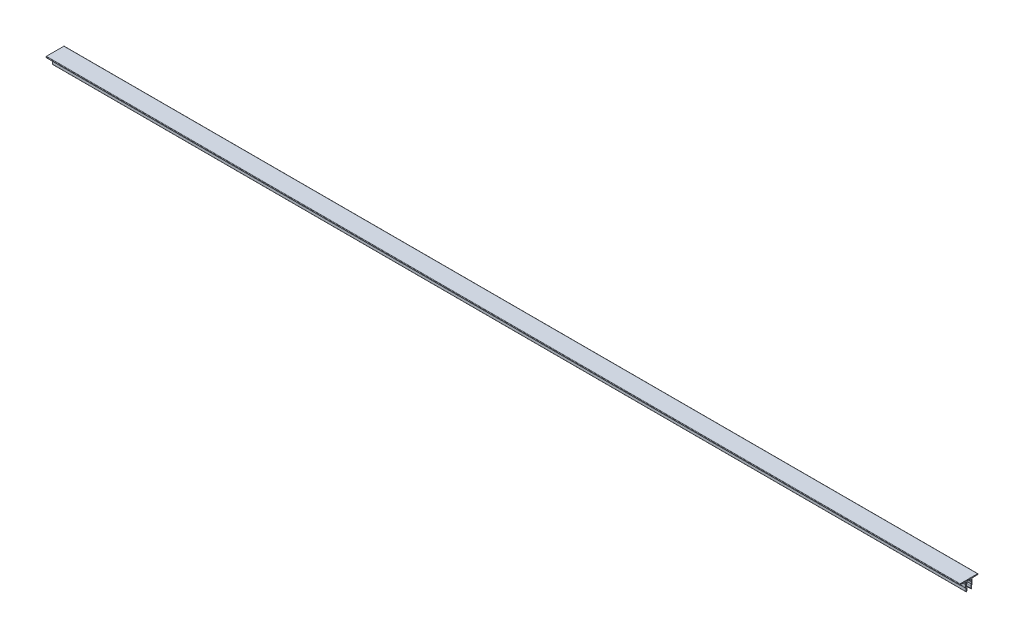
SolidWorks part; units mm, degrees
ref_plane "正面" through (0, 0, 0) normal (0, 0, 1) x (1, 0, 0)
ref_plane "平面" through (0, 0, 0) normal (0, 1, 0) x (1, 0, 0)
ref_plane "右側面" through (0, 0, 0) normal (1, 0, 0) x (0, 0, -1)
sketch "ｽｹｯﾁ2" plane through (0, 0, 0) normal (1, 0, 0) x (0, 0, -1)
  line L0 (10, -1) -> (10, -0.5)
  line L1 (-10, -1) -> (-10, -0.5)
  line L6 (-4, -1) -> (-10, -1)
  line L7 (1.7, -1) -> (-1.7, -1)
  line L67 (10, -1) -> (4, -1)
  line L68 (9.5, 0) -> (-9.5, 0)
  line L73 (2.6, -11) -> (2.8, -11)
  line L74 (-3.1, -10.7) -> (-3.1, -7.6865)
  line L75 (-2.1, -10.134) -> (-2.1, -7.6865)
  line L76 (2.1, -10.134) -> (2.1, -7.6865)
  line L77 (-2.1, -10.134) -> (-2.6, -11)
  line L78 (-2.6, -11) -> (-2.8, -11)
  line L79 (2.1, -10.134) -> (2.6, -11)
  line L80 (-3.7, -6.6472) -> (-3.7, -3.7247)
  line L81 (-2.7, -6.1765) -> (-2.7, -4.2902)
  line L82 (-2.2, -3.4242) -> (-2.2, -1.5)
  line L83 (-3.2, -2.7) -> (-3.2, -1.8)
  line L84 (2.7, -6.1765) -> (2.7, -4.2902)
  line L85 (2.2, -3.4242) -> (2.2, -1.5)
  line L86 (3.1, -10.7) -> (3.1, -7.6865)
  line L87 (3.2, -2.7) -> (3.2, -1.8)
  line L88 (3.7, -6.6472) -> (3.7, -3.7247)
  arc A0 (4, -1) -> (3.2, -1.8) centre (4, -1.8) ccw
  arc A1 (-4, -1) -> (-3.2, -1.8) centre (-4, -1.8) cw
  arc A2 (2.2, -1.5) -> (1.7, -1) centre (1.7, -1.5) ccw
  arc A3 (-1.7, -1) -> (-2.2, -1.5) centre (-1.7, -1.5) ccw
  arc A4 (10, -0.5) -> (9.5, 0) centre (9.5, -0.5) ccw
  arc A5 (-9.5, 0) -> (-10, -0.5) centre (-9.5, -0.5) ccw
  arc A71 (2.7, -4.2902) -> (2.45, -3.8572) centre (2.2, -4.2902) ccw
  arc A72 (-3.1, -10.7) -> (-2.8, -11) centre (-2.8, -10.7) ccw
  arc A73 (-3.7, -6.6472) -> (-3.45, -7.0803) centre (-3.2, -6.6472) ccw
  arc A74 (-3.1, -7.6865) -> (-3.45, -7.0803) centre (-3.8, -7.6865) ccw
  arc A75 (-3.5077, -3.3306) -> (-3.7, -3.7247) centre (-3.2, -3.7247) ccw
  arc A76 (-3.5077, -3.3306) -> (-3.2, -2.7) centre (-4, -2.7) ccw
  arc A77 (-2.45, -3.8572) -> (-2.2, -3.4242) centre (-2.7, -3.4242) ccw
  arc A78 (-2.45, -3.8572) -> (-2.7, -4.2902) centre (-2.2, -4.2902) ccw
  arc A79 (2.2, -3.4242) -> (2.45, -3.8572) centre (2.7, -3.4242) ccw
  arc A80 (2.8, -11) -> (3.1, -10.7) centre (2.8, -10.7) ccw
  arc A81 (3.45, -7.0803) -> (3.7, -6.6472) centre (3.2, -6.6472) ccw
  arc A82 (3.7, -3.7247) -> (3.5077, -3.3306) centre (3.2, -3.7247) ccw
  arc A83 (3.2, -2.7) -> (3.5077, -3.3306) centre (4, -2.7) ccw
  arc A84 (3.45, -7.0803) -> (3.1, -7.6865) centre (3.8, -7.6865) ccw
  arc A85 (-2.1, -7.6865) -> (-2.5636, -6.5197) centre (-3.8, -7.6865) ccw
  arc A86 (-2.7, -6.1765) -> (-2.5636, -6.5197) centre (-2.2, -6.1765) ccw
  arc A87 (2.5636, -6.5197) -> (2.1, -7.6865) centre (3.8, -7.6865) ccw
  arc A88 (2.5636, -6.5197) -> (2.7, -6.1765) centre (2.2, -6.1765) ccw
  dimension "D1" = 0.8
  dimension "D2" = 0.5
  dimension "D3" = 0.5
extrude "押し出し1" add sketch "ｽｹｯﾁ2" along normal blind 1000
